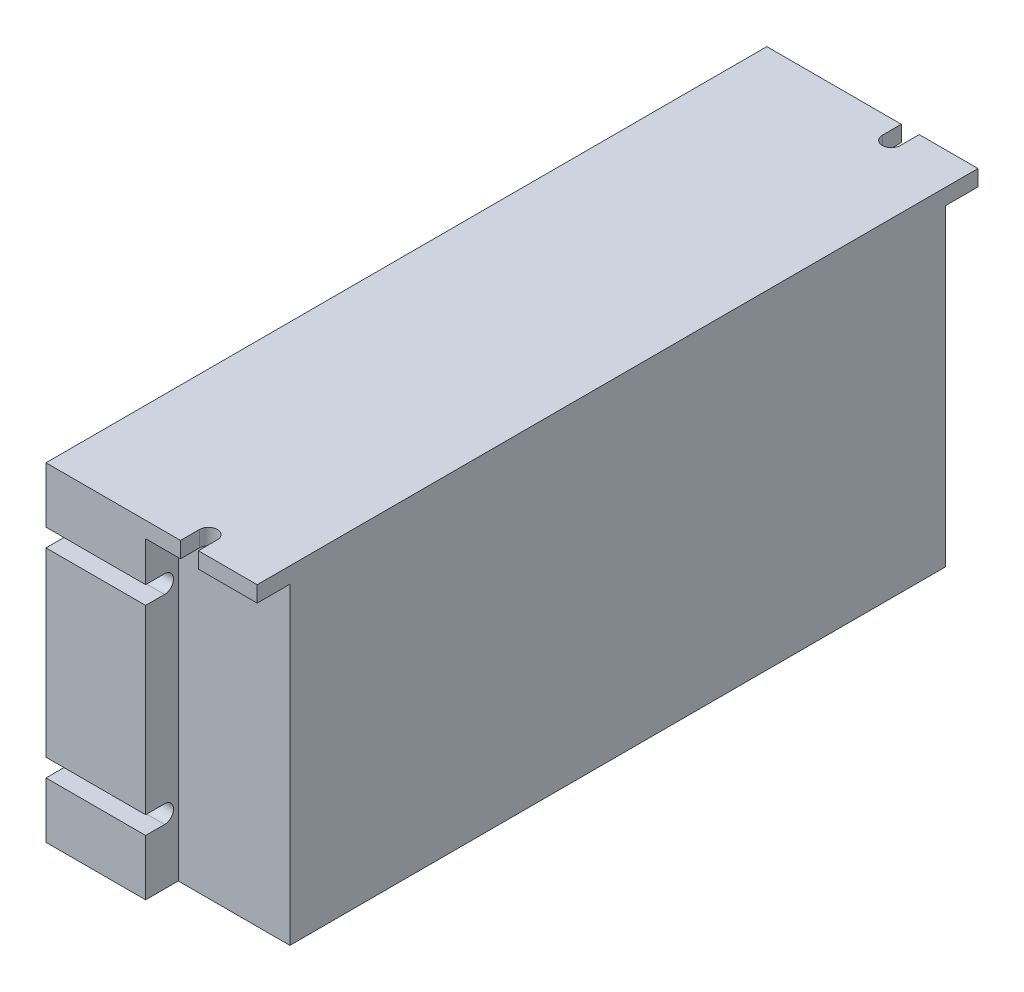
SolidWorks part; units mm, degrees
ref_plane "前视基准面" through (0, 0, 0) normal (0, 0, 1) x (1, 0, 0)
ref_plane "上视基准面" through (0, 0, 0) normal (0, 1, 0) x (1, 0, 0)
ref_plane "右视基准面" through (0, 0, 0) normal (1, 0, 0) x (0, 0, -1)
sketch "草图2" plane through (0, 0, 0) normal (1, 0, 0) x (0, 0, -1)
  line L1 (-90.45, -41.25) -> (90.45, -41.25)
  line L2 (-90.45, -41.25) -> (-90.45, 41.25)
  line L3 (-90.45, 41.25) -> (90.45, 41.25)
  line L4 (90.45, -41.25) -> (90.45, 41.25)
  line L5 (-90.45, -41.25) -> (90.45, 41.25) construction
  line L6 (-90.45, 41.25) -> (90.45, -41.25) construction
  point P0 (0, 0)
extrude "凸台-拉伸1" add sketch "草图2" along normal blind 53
sketch "草图3" plane through (53, 0, 0) normal (1, 0, 0) x (0, 0, -1)
  line L1 (-90.45, 41.25) -> (-90.45, -41.25) construction
  line L2 (-90.45, 37.25) -> (-82.25, 37.25)
  line L3 (-82.25, 37.25) -> (-82.25, -41.25)
  line L4 (-90.45, -41.25) -> (90.45, -41.25) construction
  line L5 (-90.45, -41.25) -> (-90.45, 37.25)
  line L6 (-90.45, -41.25) -> (-82.25, -41.25)
  line L7 (90.45, 37.25) -> (82.25, 37.25)
  line L8 (90.45, -41.25) -> (90.45, 41.25) construction
  line L9 (82.25, 37.25) -> (82.25, -41.25)
  line L10 (82.25, -41.25) -> (90.45, -41.25)
  line L11 (90.45, -41.25) -> (90.45, 37.25)
extrude "切除-拉伸1" cut sketch "草图3" against normal blind 28
sketch "草图4" plane through (25, 0, 0) normal (1, 0, 0) x (0, 0, -1)
  line L1 (-90.45, 37.25) -> (-90.45, -41.25) construction
  line L3 (-85.7, -22.75) -> (-90.45, -22.75)
  line L4 (-90.45, -22.75) -> (-90.45, -27.25)
  line L5 (-90.45, -27.25) -> (-85.7, -27.25)
  line L8 (-85.7, 27.25) -> (-90.45, 27.25)
  line L9 (-90.45, 27.25) -> (-90.45, 22.75)
  line L10 (-90.45, 22.75) -> (-85.7, 22.75)
  line L12 (90.45, -41.25) -> (90.45, 37.25) construction
  line L14 (85.7, 22.75) -> (90.45, 22.75)
  line L15 (90.45, 22.75) -> (90.45, 27.25)
  line L16 (90.45, 27.25) -> (85.7, 27.25)
  line L17 (85.7, -22.75) -> (90.45, -22.75)
  line L18 (90.45, -22.75) -> (90.45, -27.25)
  line L19 (90.45, -27.25) -> (85.7, -27.25)
  arc A0 (-85.7, -27.25) -> (-85.7, -22.75) centre (-85.7, -25) ccw
  arc A1 (-85.7, 22.75) -> (-85.7, 27.25) centre (-85.7, 25) ccw
  arc A2 (85.7, -22.75) -> (85.7, -27.25) centre (85.7, -25) ccw
  arc A3 (85.7, 27.25) -> (85.7, 22.75) centre (85.7, 25) ccw
extrude "切除-拉伸2" cut sketch "草图4" against normal blind 25
sketch "草图5" plane through (0, 41.25, 0) normal (0, 1, 0) x (1, 0, 0)
  line L1 (53, 90.45) -> (0, 90.45) construction
  line L2 (38.25, -85.7) -> (38.25, -90.45)
  line L3 (33.75, 85.7) -> (33.75, 90.45)
  line L4 (33.75, 90.45) -> (38.25, 90.45)
  line L5 (38.25, 90.45) -> (38.25, 85.7)
  line L6 (33.75, -85.7) -> (33.75, -90.45)
  line L7 (53, -90.45) -> (0, -90.45) construction
  line L8 (38.25, -90.45) -> (33.75, -90.45)
  arc A0 (33.75, 85.7) -> (38.25, 85.7) centre (36, 85.7) ccw
  arc A1 (38.25, -85.7) -> (33.75, -85.7) centre (36, -85.7) ccw
extrude "切除-拉伸3" cut sketch "草图5" against normal blind 4
sketch "草图6" plane through (53, 0, 0) normal (1, 0, 0) x (0, 0, -1)
  text T0 "BLD-100" font "汉仪长仿宋体" height 6
